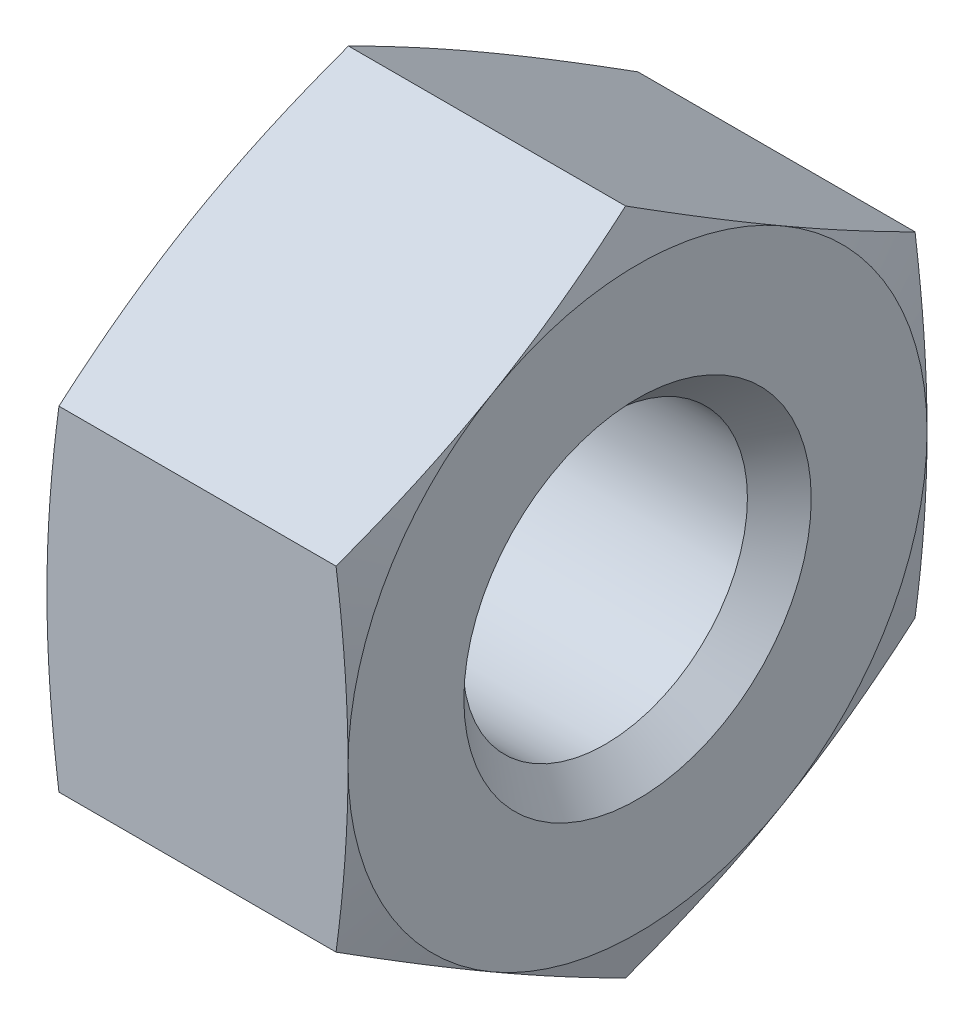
SolidWorks part; units mm, degrees
ref_plane "Plan de face" through (0, 0, 0) normal (0, 0, 1) x (1, 0, 0)
ref_plane "Plan de dessus" through (0, 0, 0) normal (0, 1, 0) x (1, 0, 0)
ref_plane "Plan de droite" through (0, 0, 0) normal (1, 0, 0) x (0, 0, -1)
imported_body "Importée3"
hole_wizard "Perçage1" positions "Esquisse2" profile "Esquisse1" legacy
sketch "Esquisse2" plane through (0, 0, 0) normal (-1, 0, 0) x (0, 0, 1)
  point P0 (0, 0)
sketch "Esquisse1" plane through (0, 0, 0) normal (0, 1, 0) x (0, 0, 1)
  line L0 (0, 0) -> (0, 5.2)
  line L1 (0, 5.2) -> (2.4585, 5.2)
  line L2 (2.4585, 5.2) -> (2.4585, 0)
  line L3 (2.4585, 0) -> (0, 0)
  line L4 (0, 110) -> (0, -10) construction
  dimension "Diamètre" = 4.917
  dimension "Profondeur" = 5.2
chamfer "Chanfrein1" distance 0.5415 angle 45 1 edges at (0, 0, 2.4585)
chamfer "Chanfrein2" distance 0.5415 angle 46 1 edges at (5.2, 0, 2.4585)
